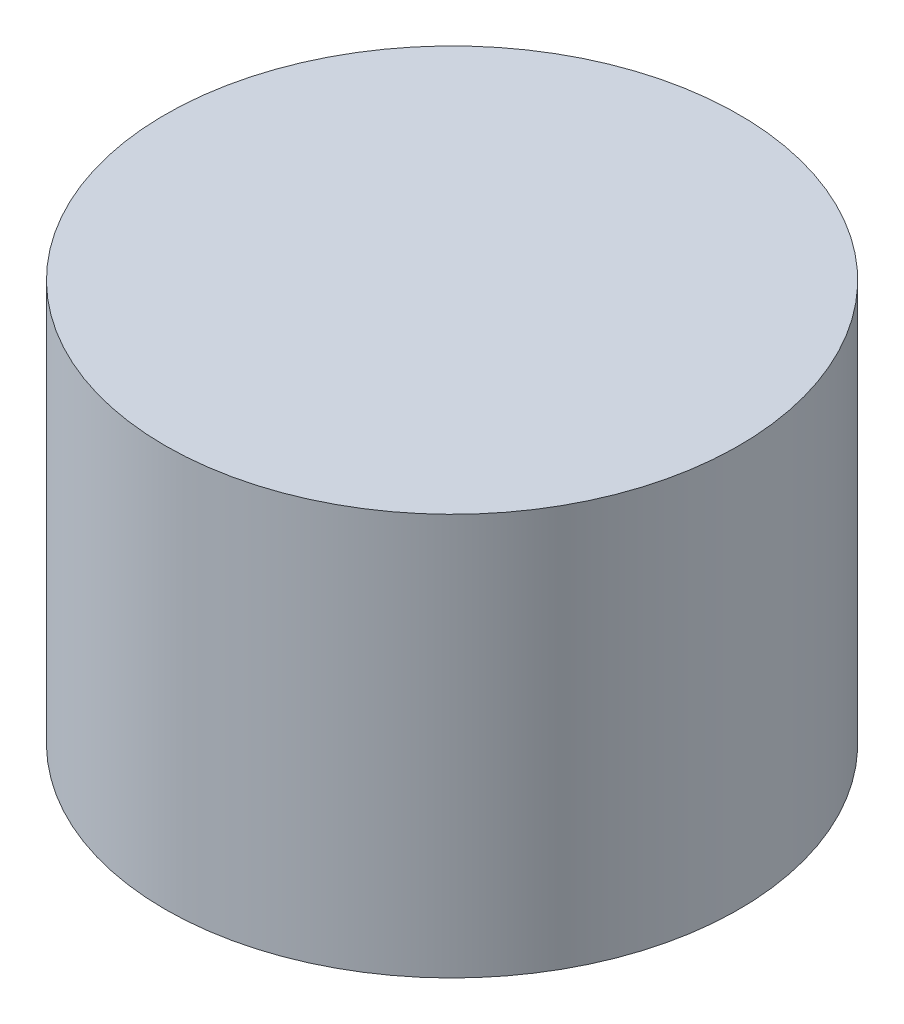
SolidWorks part; units mm, degrees
ref_plane "Front Plane" through (0, 0, 0) normal (0, 0, 1) x (1, 0, 0)
ref_plane "Top Plane" through (0, 0, 0) normal (0, 1, 0) x (1, 0, 0)
ref_plane "Right Plane" through (0, 0, 0) normal (1, 0, 0) x (0, 0, -1)
sketch "Sketch1" plane through (0, 0, 0) normal (0, 1, 0) x (1, 0, 0)
  circle A0 centre (0, 0) radius 25
  dimension "D1" = 50
extrude "Boss-Extrude1" add sketch "Sketch1" along normal blind 35
scale "Scale1" scale about centroid uniform scaling yes scale factor 0.9
